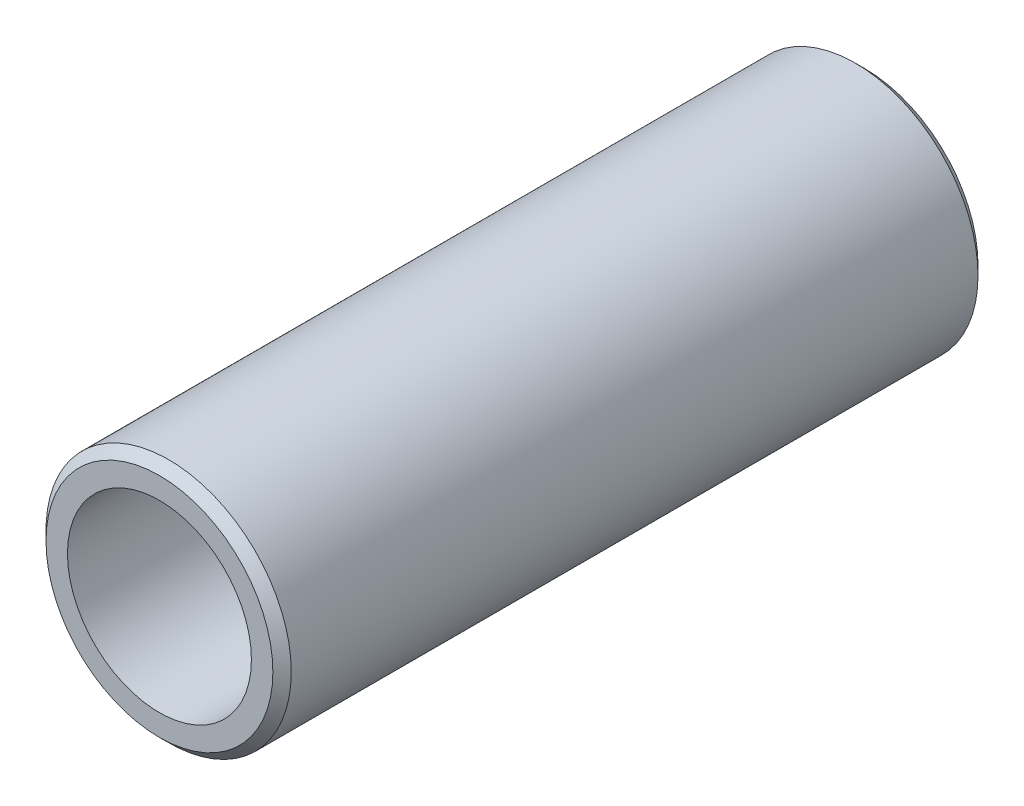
SolidWorks part; units mm, degrees
ref_plane "Face" through (0, 0, 0) normal (0, 0, 1) x (1, 0, 0)
ref_plane "Dessus" through (0, 0, 0) normal (0, 1, 0) x (1, 0, 0)
ref_plane "Droite" through (0, 0, 0) normal (1, 0, 0) x (0, 0, -1)
sketch "Esquisse1" plane through (0, 0, 0) normal (0, 0, 1) x (1, 0, 0)
  circle A0 centre (0, 0) radius 4
  dimension "D1" = 8
extrude "Extrusion1" add sketch "Esquisse1" against normal blind 23
sketch "Esquisse2" plane through (0, 0, 0) normal (0, 0, 1) x (1, 0, 0)
  circle A0 centre (0, 0) radius 3
  dimension "D1" = 6
extrude "Enlèv. mat.-Extru.1" cut sketch "Esquisse2" against normal blind 23
chamfer "Chanfrein2" distance 0.3 angle 45
